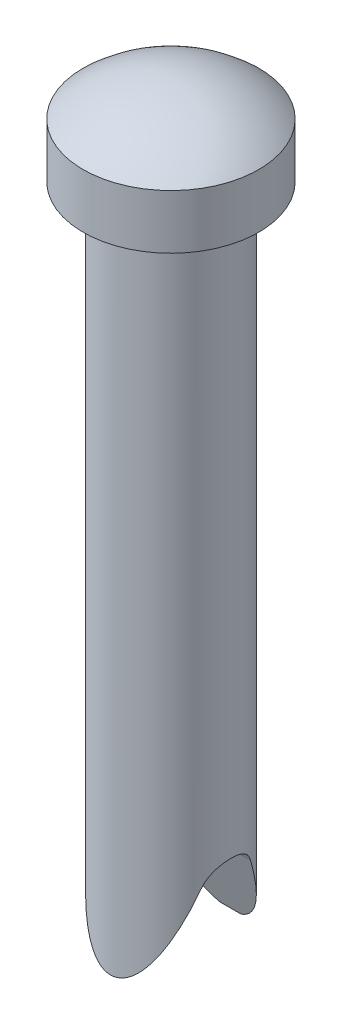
SolidWorks part; units mm, degrees
ref_plane "Front Plane" through (0, 0, 0) normal (0, 0, 1) x (1, 0, 0)
ref_plane "Top Plane" through (0, 0, 0) normal (0, 1, 0) x (1, 0, 0)
ref_plane "Right Plane" through (0, 0, 0) normal (1, 0, 0) x (0, 0, -1)
sketch "Sketch1" plane through (0, 0, 0) normal (0, 0, 1) x (1, 0, 0)
  line L7 (0, 0) -> (0, -3.678) construction
  line L8 (0, 4) -> (0.0002, 4)
  line L9 (0, 4) -> (0, 0)
  line L10 (0, 0) -> (4, 0)
  line L11 (4, 2.4721) -> (4, 0)
  arc A0 (4, 2.4721) -> (0.0002, 4) centre (0, -2) ccw
  point P3 (0.1528, 3.6496)
  point P5 (0, 0)
  point P6 (0.1548, -2.3467)
  point P11 (0, 0)
  dimension "D3" = 12
  dimension "D1" = 4
  dimension "D2" = 4
revolve "Revolve2" add sketch "Sketch1" angle 360 about L7
sketch "Sketch10" plane through (0, 0, 0) normal (0, -1, 0) x (1, 0, 0)
sketch "Sketch13" plane through (0, 0, 0) normal (0, -1, 0) x (1, 0, 0)
  circle A0 centre (0, 0) radius 2.75
  dimension "D1" = 5.5
extrude "Boss-Extrude2" add sketch "Sketch13" along normal blind 30
sketch "Sketch15" plane through (0, 0, 0) normal (1, 0, 0) x (0, 0, -1)
  line L0 (-2.7871, -30) -> (-1.1129, -26.0333)
  line L1 (1.1044, -26.0482) -> (2.7104, -30)
  line L2 (2.7104, -30) -> (-2.7871, -30)
  line L3 (-2.75, -30) -> (2.75, -30) construction
  arc A0 (-1.1129, -26.0333) -> (1.1044, -26.0482) centre (-0.0073, -26.5) cw
  point P7 (0.0007, -25.3)
  dimension "D1" = 1.2
  dimension "D2" = 0
  dimension "D3" = 4.7
  dimension "D4" = 45
extrude "Cut-Extrude1" cut sketch "Sketch15" against normal through all and the other way through all
